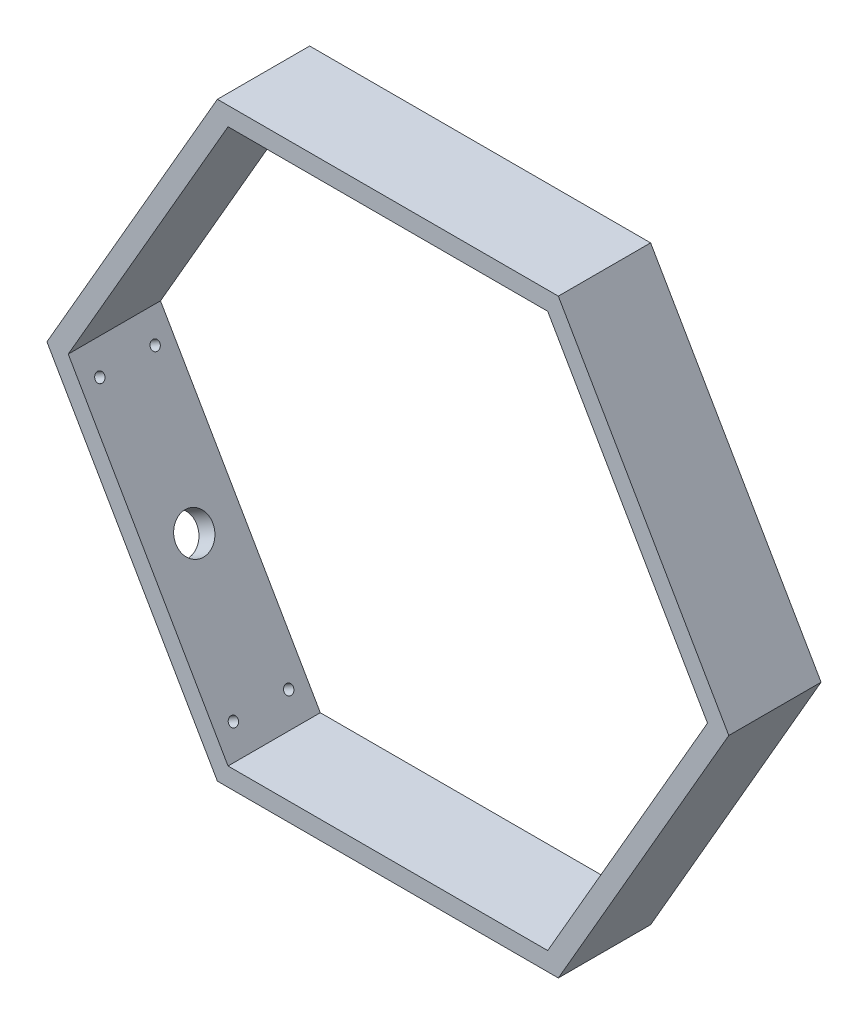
SolidWorks part; units mm, degrees
ref_plane "Front Plane" through (0, 0, 0) normal (0, 0, 1) x (1, 0, 0)
ref_plane "Top Plane" through (0, 0, 0) normal (0, 1, 0) x (1, 0, 0)
ref_plane "Right Plane" through (0, 0, 0) normal (1, 0, 0) x (0, 0, -1)
sketch "Sketch1" plane through (0, 0, 0) normal (0, 0, 1) x (1, 0, 0)
  line L1 (117.3176, 0) -> (58.6588, 101.6)
  line L2 (58.6588, 101.6) -> (-58.6588, 101.6)
  line L3 (-58.6588, 101.6) -> (-117.3176, 0)
  line L4 (-117.3176, 0) -> (-58.6588, -101.6)
  line L5 (-58.6588, -101.6) -> (58.6588, -101.6)
  line L6 (58.6588, -101.6) -> (117.3176, 0)
  line L7 (54.9926, 95.25) -> (-54.9926, 95.25)
  line L8 (-54.9926, 95.25) -> (-109.9852, 0)
  line L9 (-109.9852, 0) -> (-54.9926, -95.25)
  line L10 (-54.9926, -95.25) -> (54.9926, -95.25)
  line L11 (54.9926, -95.25) -> (109.9852, 0)
  line L12 (109.9852, 0) -> (54.9926, 95.25)
  dimension "D1" = 117.3176
  dimension "D3" = 190.5
  dimension "D2" = 203.2
extrude "Boss-Extrude1" add sketch "Sketch1" along normal blind 31.75
sketch "Sketch9" plane through (-87.9882, -50.8, 0) normal (-0.866, -0.5, 0) x (0, 0, 1)
  line L0 (6.35, 45.9588) -> (25.4, 45.9588) construction
  line L1 (25.4, 45.9588) -> (25.4, -45.9588) construction
  line L2 (25.4, -45.9588) -> (6.35, -45.9588) construction
  line L3 (6.35, -45.9588) -> (6.35, 45.9588) construction
  line L4 (31.75, 58.6588) -> (0, 58.6588) construction
  line L5 (0, 58.6588) -> (0, -58.6588) construction
  line L6 (31.75, -58.6588) -> (0, -58.6588) construction
  line L7 (31.75, 58.6588) -> (31.75, -58.6588) construction
  line L8 (6.35, 45.9588) -> (25.4, -45.9588) construction
  line L9 (25.4, 45.9588) -> (6.35, -45.9588) construction
  circle A0 centre (6.35, 45.9588) radius 1.5875
  circle A1 centre (25.4, 45.9588) radius 1.5875
  circle A2 centre (6.35, -45.9588) radius 1.5875
  circle A3 centre (25.4, -45.9588) radius 1.5875
  circle A4 centre (15.875, 0) radius 6.35
  dimension "D5" = 3.175
  dimension "D6" = 3.175
  dimension "D7" = 12.7
  dimension "D8" = 3.175
  dimension "D9" = 3.175
  dimension "D1" = 12.7
  dimension "D2" = 12.7
  dimension "D3" = 6.35
  dimension "D4" = 6.35
  dimension "D10" = 19.05
  dimension "D11" = 15.875
extrude "Cut-Extrude1" cut sketch "Sketch9" against normal up to next
